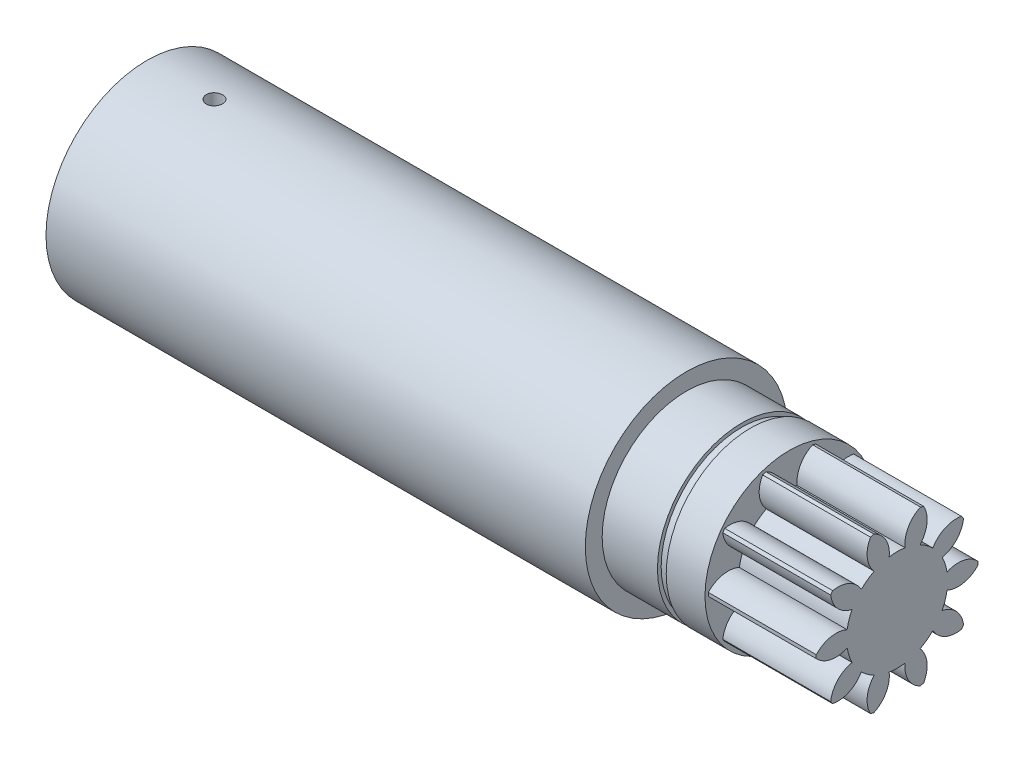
SolidWorks part; units mm, degrees
ref_plane "Plane1" through (0, 0, 0) normal (0, 0, 1) x (1, 0, 0)
ref_plane "Plane2" through (0, 0, 0) normal (0, 1, 0) x (1, 0, 0)
ref_plane "Plane3" through (0, 0, 0) normal (1, 0, 0) x (0, 0, -1)
sketch "HoldingSke" plane through (0, 0, 0) normal (0, 1, 0) x (1, 0, 0)
  line L0 (0, 0) -> (0.4924, -0.0868)
  line L1 (-15, 0) -> (100, 0) construction
  line L2 (0, 0) -> (-2.1039, 2.3779)
  line L3 (0, 0) -> (-11.863, 4.5341)
  line L4 (0, 0) -> (8.5048, 1.4996)
  line L5 (0, 0) -> (-46.8476, -17.4728)
  line L6 (0, 0) -> (-13.2634, -8.9489)
  line L7 (-2.1039, 2.3779) -> (8.6586, 51.2059)
  line L8 (-76.2, 54.61) -> (-73.9, 54.61)
  line L9 (-71.009, 38.7566) -> (-53.1078, 45.2721)
  line L10 (-76.2, 71.12) -> (104.1128, 71.12)
  line L11 (0, 0) -> (-16, 0)
  line L12 (-76.2, 101.6) -> (-76.133, 101.6)
  line L13 (24.9733, 27.94) -> (52.9518, 28.4284)
  line L14 (24.9733, 27.94) -> (24.9743, 27.94)
  line L15 (24.9733, 27.94) -> (100.4006, 29.5858)
  line L16 (-63.627, -2) -> (-12.827, -2)
  circle A0 centre (0, 0) radius 8
  circle A1 centre (0, 0) radius 7.499
  circle A2 centre (0, 0) radius 37.5
  circle A3 centre (0, 0) radius 7.4736
  dimension "MHD" = 14.998
  dimension "Hub_dia" = 75
  dimension "Bore" = 16
  dimension "MBD" = 14.9472
  dimension "Num_teeth" = 10
  dimension "Pitch_radius" = 180.3128
  dimension "Pitch" = 0.5
  dimension "Width" = 16
  dimension "Overall_len" = 50
  dimension "Show_teeth" = 10
  dimension "Thickness" = 16
  dimension "OAL" = 50.0001
  dimension "T_dim" = 2.3
  dimension "Ap" = 20
  dimension "H" = 19.05
  dimension "Backlash" = 0.067
  dimension "Addendum_fac" = 1
  dimension "Dedendum_fac" = 1.25
  dimension "Clearance_fac" = 0.25
  dimension "Dedendum_add" = 0.001
  dimension "Module" = 2
sketch "BasProSke" plane through (0, 0, 0) normal (0, 1, 0) x (1, 0, 0)
  line L0 (-10, 0) -> (60, 0) construction
  line L1 (0, 0) -> (0, 12)
  line L2 (0, 0) -> (16, 0)
  line L3 (16, 0) -> (16, 12)
  line L4 (16, 12) -> (0, 12)
  dimension "Diameter" = 24
  dimension "Thickness" = 16
revolve "Base-Revolve" add sketch "BasProSke" angle 360 about L0
sketch "TooCutSke" plane through (0, 0, 0) normal (1, 0, 0) x (0, 0, -1)
  line L1 (0, 0) -> (0, 107) construction
  line L2 (0, 0) -> (-1.6814, 9.8576) construction
  line L3 (0, 0) -> (-6.1153, 18.8209) construction
  line L4 (-1.6814, 9.8576) -> (-3.0576, 9.4105) construction
  arc A0 (1.1737, 7.4066) -> (-1.1737, 7.4066) centre (0, 0) ccw
  arc A1 (3.4979, 11.5054) -> (-3.4979, 11.5054) centre (0, 0) ccw
  circle A2 centre (0, 0) radius 10 construction
  circle A3 centre (0, 0) radius 9.3969 construction
  arc A4 (-1.1737, 7.4066) -> (-3.4979, 11.5054) centre (-5.1477, 7.8615) ccw
  arc A5 (3.4979, 11.5054) -> (1.1737, 7.4066) centre (5.1477, 7.8615) ccw
  dimension "Root_dia" = 14.998
  dimension "Overcut_dia" = 24.0508
  dimension "Pitch_dia" = 20
  dimension "Base_dia" = 18.7939
  dimension "Flank_rad" = 4
  dimension "Half_ang" = 18
  dimension "Half_CT" = 1.4471
extrude "ToothCut" cut sketch "TooCutSke" along normal through all
fillet "Breaks" [suppressed] radius 0.04
fillet "RootFillets" [suppressed] radius 0.501
pattern_circular "TeethCuts" count 10 every 36 about axis through (-10, 0, 0) along (1, 0, 0) of "ToothCut", "RootFillets", "Breaks"
sketch "HubNeaOneSke" plane through (0, 0, 0) normal (-1, 0, 0) x (0, 0, 1)
  circle A0 centre (0, 0) radius 7.499
  dimension "Diameter" = 14.998
extrude "HubNearOne" [suppressed] add sketch "HubNeaOneSke" along normal blind 34.0001
sketch "HubNeaBotSke" plane through (0, 0, 0) normal (-1, 0, 0) x (0, 0, 1)
  circle A0 centre (0, 0) radius 7.499
  dimension "Diameter" = 14.998
extrude "HubNearBoth" [suppressed] add sketch "HubNeaBotSke" along normal blind 17
ref_plane "FarPln" through (16, 0, 0) normal (1, 0, 0) x (0, 0, -1)
sketch "HubFarSke" plane through (16, 0, 0) normal (1, 0, 0) x (0, 0, -1)
  circle A0 centre (0, 0) radius 7.499
  dimension "Diameter" = 14.998
extrude "HubFar" [suppressed] add sketch "HubFarSke" along normal blind 17
sketch "BorSke" plane through (0, 0, 0) normal (1, 0, 0) x (0, 0, -1)
  circle A0 centre (0, 0) radius 7.4736
  dimension "Diameter" = 14.9472
extrude "Bore" cut sketch "BorSke" along normal mid plane 100.0001
sketch "KeySke" plane through (0, 0, 0) normal (1, 0, 0) x (0, 0, -1)
  line L0 (-2.5, 0) -> (-2.5, 9.7736)
  line L1 (-2.5, 9.7736) -> (2.5, 9.7736)
  line L2 (2.5, 9.7736) -> (2.5, 0)
  line L3 (0, 0) -> (0, 34) construction
  line L4 (-2.5, 0) -> (2.5, 0)
  dimension "Offset" = 9.7736
  dimension "Width" = 5
extrude "Keyway" [suppressed] cut sketch "KeySke" along normal mid plane 100.0001
pattern_circular "Keyway2" [suppressed] count 2 every 90 about axis through (-10, 0, 0) along (1, 0, 0)
sketch "Esquisse1" plane through (16, 0, 0) normal (1, 0, 0) x (0, 0, -1)
  circle A0 centre (0, 0) radius 7.499
  arc A1 (3.404, -6.6819) -> (5.303, -5.3022) centre (0, 0) ccw construction
extrude "Extrusion2" add sketch "Esquisse1" against normal blind 16
sketch "Esquisse2" plane through (0, 0, 0) normal (-1, 0, 0) x (0, 0, 1)
  circle A0 centre (0, 0) radius 12.5
  dimension "D1" = 25
extrude "Extrusion3" add sketch "Esquisse2" along normal blind 5.75
sketch "Esquisse3" plane through (-5.75, 0, 0) normal (-1, 0, 0) x (0, 0, 1)
  circle A0 centre (0, 0) radius 11.95
  dimension "D1" = 23.9
extrude "Extrusion4" add sketch "Esquisse3" along normal blind 1.3
sketch "Esquisse4" plane through (-7.05, 0, 0) normal (-1, 0, 0) x (0, 0, 1)
  circle A0 centre (0, 0) radius 12.5
  dimension "D1" = 25
extrude "Extrusion5" add sketch "Esquisse4" along normal blind 8.2
sketch "Esquisse5" plane through (-15.25, 0, 0) normal (-1, 0, 0) x (0, 0, 1)
  circle A0 centre (0, 0) radius 15
  dimension "D1" = 30
extrude "Extrusion6" add sketch "Esquisse5" along normal blind 80
ref_plane "Plan1" through (0, 15, 0) normal (0, 1, 0) x (-1, 0, 0)
hole_wizard "Dégagement M21" positions "Esquisse8" profile "Esquisse7" hole size "M2" standard "ISO"
sketch "Esquisse8" plane through (0, 15, 0) normal (0, 1, 0) x (-1, 0, 0)
  line L0 (95.25, -15) -> (95.25, 15) construction
  point P0 (85.25, 0)
  dimension "D1" = 10
sketch "Esquisse7" plane through (-85.25, 15, 0) normal (1, 0, 0) x (0, 0, 1)
  line L0 (0, 0) -> (0, 30)
  line L1 (0, 30) -> (1.2, 30)
  line L2 (1.2, 30) -> (1.2, 0)
  line L5 (1.2, 0) -> (0, 0)
  line L11 (0, -6.35) -> (0, 107.95) construction
  dimension "Diamètre du perçage jusqu'au prochain" = 2.4
  dimension "Profondeur du perçage jusqu'au prochain" = 30
sketch "Esquisse9" plane through (-95.25, 0, 0) normal (-1, 0, 0) x (0, 0, 1)
  line L0 (-7, 7.1414) -> (-7, -7.1414)
  line L1 (7, -7.1414) -> (7, 7.1414)
  arc A0 (7, 7.1414) -> (-7, 7.1414) centre (0, 0) ccw
  arc A1 (-7, -7.1414) -> (7, -7.1414) centre (0, 0) ccw
  dimension "D1" = 20
  dimension "D2" = 7
  dimension "D3" = 7
extrude "Enlèv. mat.-Extru.1" cut sketch "Esquisse9" against normal blind 20
equation "' \"Module@HoldingSke\" = 6.35"
equation "' \"Num_teeth@HoldingSke\" = 12"
equation "' \"Ap@HoldingSke\" =  20"
equation "' \"Width@HoldingSke\" = 0.5 * 25.4"
equation "' \"Hub_dia@HoldingSke\"= 1 * 25.4"
equation "' \"Overall_len@HoldingSke\" = 1.0 * 25.4"
equation "' \"Bore@HoldingSke\" = 0.75 * 25.4"
equation "' \"T_dim@HoldingSke\" = 0.1 * 25.4"
equation "' \"Width@KeySke\" = 0.25 * 25.4"
equation "' \"Show_teeth@HoldingSke\" = 13"
equation "' \"Backlash@HoldingSke\" = 0.009 * 25.4"
equation "' \"Addendum_fac@HoldingSke\" = 1.0"
equation "' \"Dedendum_fac@HoldingSke\" = 1.25"
equation "' \"Dedendum_add@HoldingSke\" = 0.00005 * 25.4"
equation "' \"Clearance_fac@HoldingSke\" = 0.25"
equation "\"Pitch@HoldingSke\" = 1 / \"Module@HoldingSke\""
equation "\"Overcut_dia@TooCutSke\" = (\"Num_teeth@HoldingSke\" + 2 * \"Addendum_fac@HoldingSke\") / \"Pitch@HoldingSke\" + 0.002 * 25.4"
equation "\"Pitch_dia@TooCutSke\" = \"Num_teeth@HoldingSke\" / \"Pitch@HoldingSke\""
equation "\"Base_dia@TooCutSke\" = \"Num_teeth@HoldingSke\" / \"Pitch@HoldingSke\" * cos((\"Ap@HoldingSke\"  * 3.14159265 / 180))"
equation "\"Root_dia@TooCutSke\" = (\"Num_teeth@HoldingSke\" + 2) / \"Pitch@HoldingSke\" - 2 * (\"Addendum_fac@HoldingSke\" + \"Dedendum_fac@HoldingSke\") / \"Pitch@HoldingSke\" - \"Dedendum_add@HoldingSke\" * 2"
equation "\"Half_ang@TooCutSke\" = 180 / \"Num_teeth@HoldingSke\""
equation "\"Half_CT@TooCutSke\" = \"Num_teeth@HoldingSke\" / \"Pitch@HoldingSke\" * sin((3.14159265 / 2 / \"Num_teeth@HoldingSke\")) / 2 - 7 * \"Backlash@HoldingSke\" / 4"
equation "\"Flank_rad@TooCutSke\" = \"Num_teeth@HoldingSke\" / \"Pitch@HoldingSke\" / 5"
equation "\"Radius@RootFillets\" = \"Clearance_fac@HoldingSke\" / \"Pitch@HoldingSke\" + \"Dedendum_add@HoldingSke\""
equation "\"Break_rad@Breaks\" = 0.02 / \"Pitch@HoldingSke\""
equation "\"Thickness@HoldingSke\" = \"Width@HoldingSke\""
equation "\"OAL@HoldingSke\" = \"Thickness@HoldingSke\""
equation "\"MHD@HoldingSke\" = (\"Num_teeth@HoldingSke\" + 2) / \"Pitch@HoldingSke\" - 2 * (\"Addendum_fac@HoldingSke\" + \"Dedendum_fac@HoldingSke\")  / \"Pitch@HoldingSke\" - \"Dedendum_add@HoldingSke\" * 2"
equation "\"MBD@HoldingSke\" = (\"Num_teeth@HoldingSke\" + 2) / \"Pitch@HoldingSke\" - 2 * (\"Addendum_fac@HoldingSke\" + \"Dedendum_fac@HoldingSke\")  / \"Pitch@HoldingSke\" - \"Dedendum_add@HoldingSke\" * 2 - 0.002 * 25.4"
equation "\"MHD@HoldingSke\" = ((sgn( \"MHD@HoldingSke\" - \"Hub_dia@HoldingSke\" )-1)*( \"MHD@HoldingSke\" - \"Hub_dia@HoldingSke\" ))/-2+ \"Hub_dia@HoldingSke\""
equation "\"MBD@HoldingSke\" = ((sgn( \"MBD@HoldingSke\" - \"Bore@HoldingSke\" )-1)*( \"MBD@HoldingSke\" - \"Bore@HoldingSke\" ))/-2+ \"Bore@HoldingSke\""
equation "\"OAL@HoldingSke\" = ((sgn( \"OAL@HoldingSke\" - \"Overall_len@HoldingSke\" )+1)*( \"OAL@HoldingSke\" - \"Overall_len@HoldingSke\" ))/2 + \"Overall_len@HoldingSke\" + 0.000002 * 25.4"
equation "\"Num_teeth@TeethCuts\" = int( \"Show_teeth@HoldingSke\" ) + 1"
equation "\"Num_teeth@TeethCuts\" = ((sgn( \"Num_teeth@TeethCuts\" - \"Num_teeth@HoldingSke\" )-1)*( \"Num_teeth@TeethCuts\" - \"Num_teeth@HoldingSke\" ))/-2+ \"Num_teeth@HoldingSke\""
equation "\"Num_teeth@TeethCuts\" = ((sgn( \"Num_teeth@TeethCuts\" - 2.0)+1)*( \"Num_teeth@TeethCuts\" - 2.0))/2 +2.0"
equation "\"Angle@TeethCuts\" = 360.0 / \"Num_teeth@HoldingSke\""
equation "\"Diameter@BasProSke\" = (\"Num_teeth@HoldingSke\" + 2 * \"Addendum_fac@HoldingSke\") / \"Pitch@HoldingSke\""
equation "\"Thickness@BasProSke\"  = \"Thickness@HoldingSke\""
equation "' \"Fillet_rad@BasProSke\" =  \"Thickness@HoldingSke\" * 0.05"
equation "\"MHD@HoldingSke\" = ((sgn( \"MHD@HoldingSke\" - \"Root_dia@TooCutSke\" )-1)*( \"MHD@HoldingSke\" - \"Root_dia@TooCutSke\" ))/-2+ \"Root_dia@TooCutSke\""
equation "\"Diameter@HubNeaOneSke\" = \"MHD@HoldingSke\""
equation "\"Length@HubNearOne\" = \"OAL@HoldingSke\" - \"Thickness@BasProSke\""
equation "\"Diameter@HubNeaBotSke\" = \"MHD@HoldingSke\""
equation "\"Length@HubNearBoth\" = ( \"OAL@HoldingSke\" - \"Thickness@BasProSke\" ) / 2.0"
equation "\"Thickness@FarPln\" = \"Thickness@BasProSke\""
equation "\"Diameter@HubFarSke\" = \"MHD@HoldingSke\""
equation "\"Length@HubFar\" = ( \"OAL@HoldingSke\" - \"Thickness@BasProSke\" ) / 2.0"
equation "\"Diameter@BorSke\" = \"MBD@HoldingSke\""
equation "\"D1@Bore\" = \"OAL@HoldingSke\" * 2.0"
equation "\"D1@Keyway\" = \"OAL@HoldingSke\" * 2.0"
equation "\"Offset@KeySke\" = \"T_dim@HoldingSke\" + \"MBD@HoldingSke\" / 2.0"
